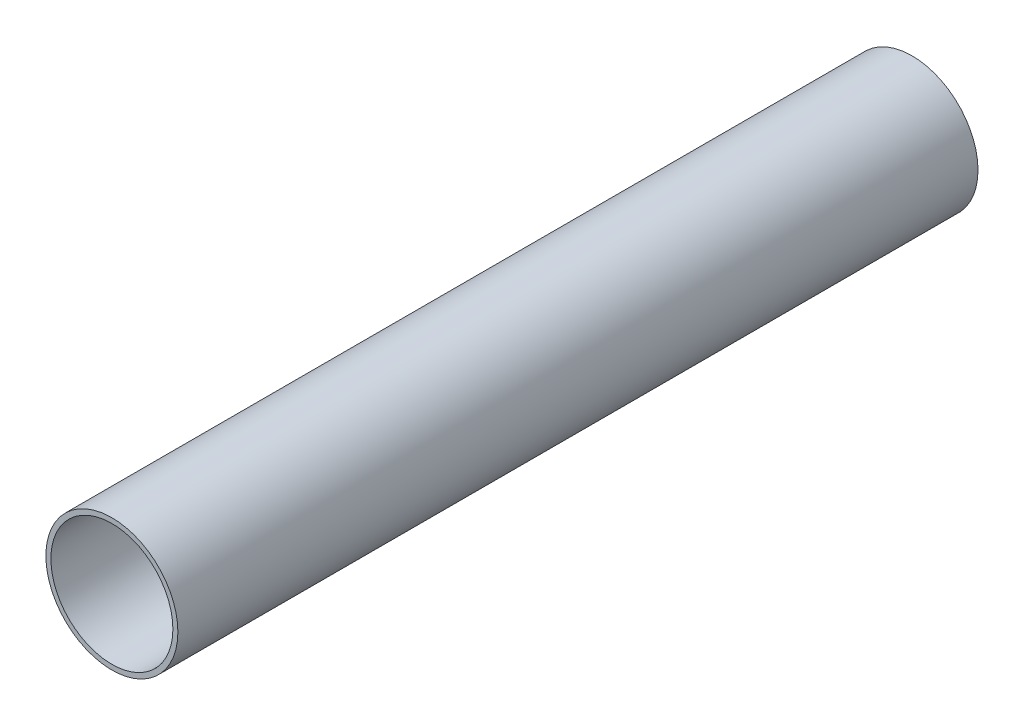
SolidWorks part; units mm, degrees
ref_plane "Front Plane" through (0, 0, 0) normal (0, 0, 1) x (1, 0, 0)
ref_plane "Top Plane" through (0, 0, 0) normal (0, 1, 0) x (1, 0, 0)
ref_plane "Right Plane" through (0, 0, 0) normal (1, 0, 0) x (0, 0, -1)
sketch "Sketch1" plane through (0, 0, 0) normal (0, 0, 1) x (1, 0, 0)
  circle A0 centre (0, 0) radius 20.955
  circle A1 centre (0, 0) radius 19.3675
  dimension "D1" = 38.735
  dimension "D2" = 41.91
extrude "Extrude1" add sketch "Sketch1" along normal blind 254
